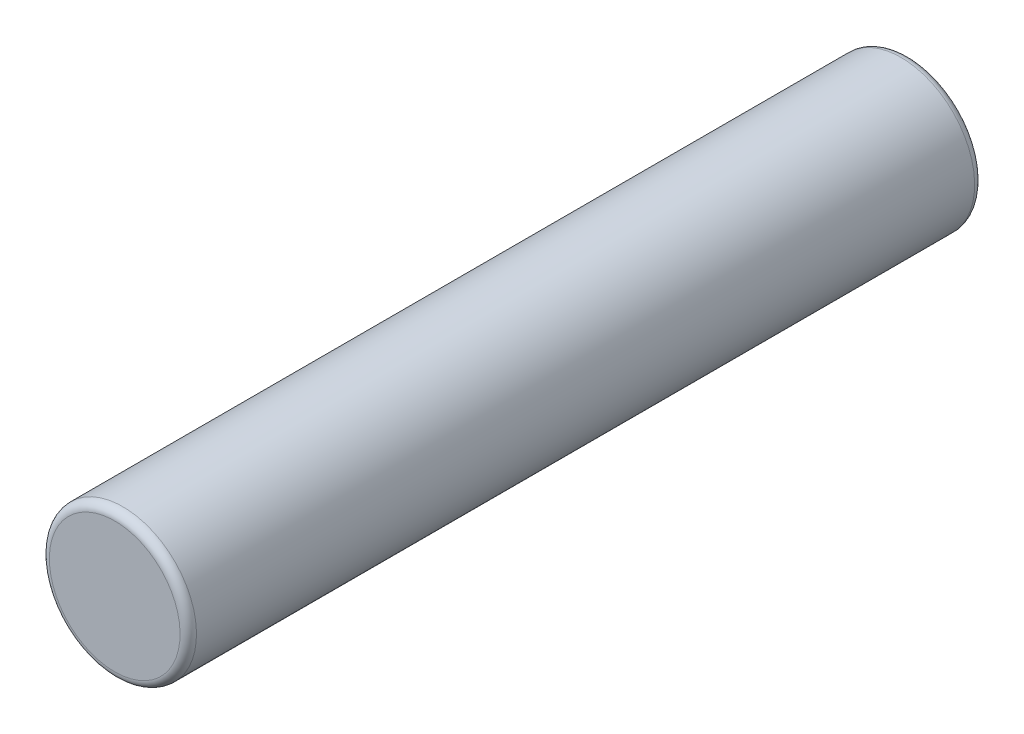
SolidWorks part; units mm, degrees
ref_plane "Спереди" through (0, 0, 0) normal (0, 0, 1) x (1, 0, 0)
ref_plane "Сверху" through (0, 0, 0) normal (0, 1, 0) x (1, 0, 0)
ref_plane "Справа" through (0, 0, 0) normal (1, 0, 0) x (0, 0, -1)
sketch "Эскиз1" plane through (0, 0, 0) normal (1, 0, 0) x (0, 0, -1)
  line L0 (-19.2405, 0) -> (50.5023, 0) construction
  line L2 (-19.2405, 0) -> (19.2405, 0)
  line L3 (-19.2405, 0) -> (-19.2405, 3.1655)
  line L4 (-18.8436, 3.5624) -> (18.8436, 3.5624)
  line L5 (19.2405, 0) -> (19.2405, 3.1655)
  arc A0 (18.8436, 3.5624) -> (19.2405, 3.1655) centre (18.8436, 3.1655) cw
  arc A1 (-19.2405, 3.1655) -> (-18.8436, 3.5624) centre (-18.8436, 3.1655) cw
  dimension "D3" = 0.3969
  dimension "D1" = 7.1247
  dimension "D2" = 38.481
revolve "Повернуть1" add sketch "Эскиз1" angle 360 mid plane about L0
